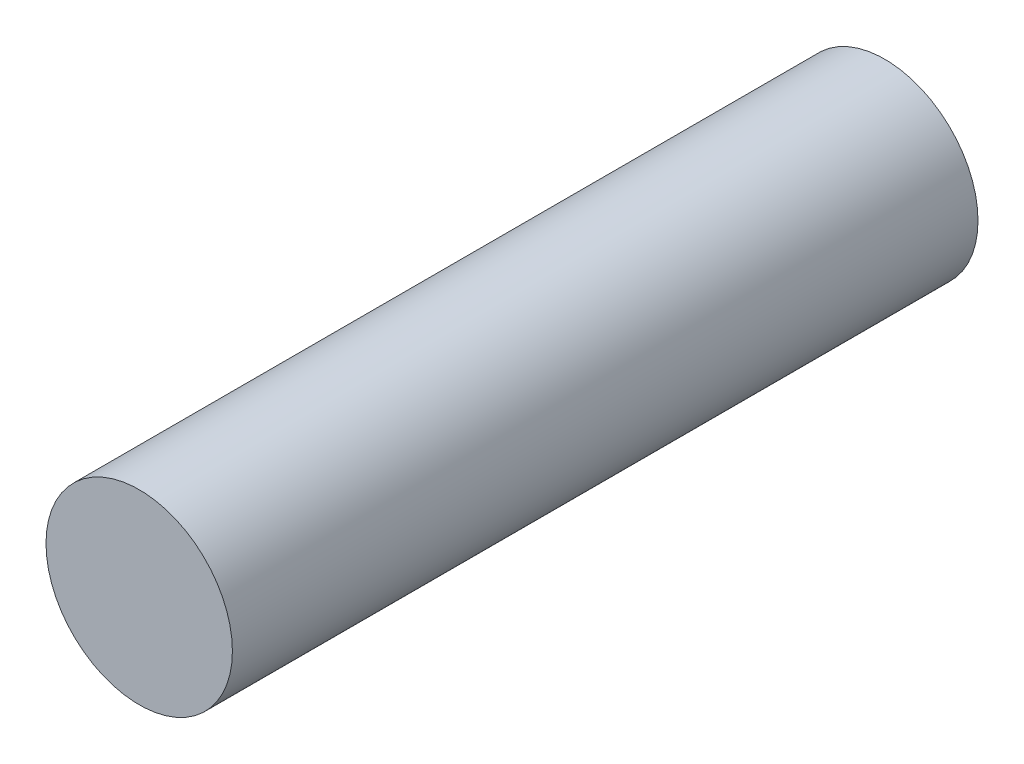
SolidWorks part; units mm, degrees
ref_plane "Face" through (0, 0, 0) normal (0, 0, 1) x (1, 0, 0)
ref_plane "Dessus" through (0, 0, 0) normal (0, 1, 0) x (1, 0, 0)
ref_plane "Droite" through (0, 0, 0) normal (1, 0, 0) x (0, 0, -1)
sketch "Esquisse1" plane through (0, 0, 0) normal (0, 0, 1) x (1, 0, 0)
  circle A0 centre (0, 0) radius 1.25
extrude "Base-Extrusion" add sketch "Esquisse1" along normal blind 10
